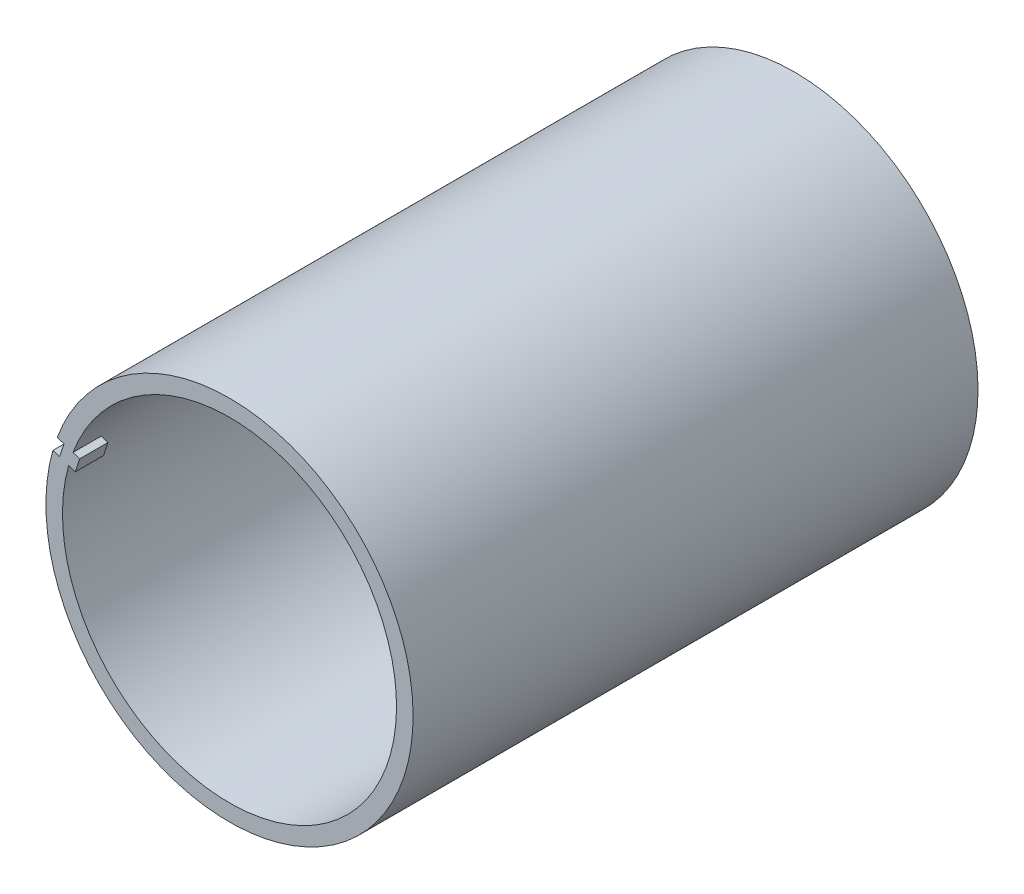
SolidWorks part; units mm, degrees
ref_plane "Plan1" through (0, 0, 0) normal (0, 0, 1) x (1, 0, 0)
ref_plane "Plan2" through (0, 0, 0) normal (0, 1, 0) x (1, 0, 0)
ref_plane "Plan3" through (0, 0, 0) normal (1, 0, 0) x (0, 0, -1)
sketch "Esquisse1" plane through (0, 0, 0) normal (0, 0, 1) x (1, 0, 0)
  line L0 (0, 24.7771) -> (-28.5317, 34.0476) construction
  line L1 (0, 24.7771) -> (-14.014, 24.7771) construction
  line L2 (-21.2123, 32.7209) -> (-22.1634, 33.0299)
  line L3 (-21.8303, 30.8188) -> (-22.7814, 31.1278)
  line L4 (-23.4473, 33.4471) -> (-24.0653, 31.5449)
  line L8 (-23.4473, 33.4471) -> (-24.3983, 33.7561)
  line L9 (-24.0653, 31.5449) -> (-25.0164, 31.854)
  line L10 (-21.2123, 32.7209) -> (-21.8303, 30.8188)
  circle A1 centre (0, 24.7771) radius 23.65 construction
  arc A2 (-25.0164, 31.854) -> (-24.3983, 33.7561) centre (0, 24.7771) ccw
  arc A3 (-22.7814, 31.1278) -> (-22.1634, 33.0299) centre (0, 24.7771) ccw
  arc A4 (6.7318, -4.4578) -> (-6.7318, -4.4578) centre (0, 24.7771) ccw construction
  dimension "D1" = 18
  dimension "D2" = 1
  dimension "D3" = 2
  dimension "D4" = 2.35
  dimension "D5" = 1
extrude "Base-Extrusion" add sketch "Esquisse1" along normal blind 4
sketch "Esquisse2" plane through (0, 0, 4) normal (0, 0, 1) x (1, 0, 0)
  circle A0 centre (0, 24.7771) radius 23.65
  circle A1 centre (0, 24.7771) radius 25.9981
  arc A2 (-22.7814, 31.1278) -> (-22.1634, 33.0299) centre (0, 24.7771) ccw construction
  arc A3 (-25.0164, 31.854) -> (-24.3983, 33.7561) centre (0, 24.7771) ccw construction
extrude "Boss.-Extru.1" add sketch "Esquisse2" along normal blind 72
sketch "Esquisse6" plane through (0, 0, 76) normal (0, 0, 1) x (1, 0, 0)
  line L0 (-24.3983, 33.7561) -> (-23.4473, 33.4471)
  line L1 (-23.4473, 33.4471) -> (-24.0653, 31.5449)
  line L2 (-24.0653, 31.5449) -> (-25.0164, 31.854)
  line L3 (-21.2123, 32.7209) -> (-22.1634, 33.0299)
  line L5 (-21.2123, 32.7209) -> (-21.8303, 30.8188)
  line L6 (-21.8303, 30.8188) -> (-22.7814, 31.1278)
  circle A1 centre (0, 24.7771) radius 23.65 construction
  circle A2 centre (0, 24.7771) radius 25.9981 construction
  arc A3 (-22.7814, 31.1278) -> (-22.1634, 33.0299) centre (0, 24.7771) ccw
  arc A4 (-25.0164, 31.854) -> (-24.3983, 33.7561) centre (0, 24.7771) ccw
extrude "Boss.-Extru.2" add sketch "Esquisse6" along normal blind 4
